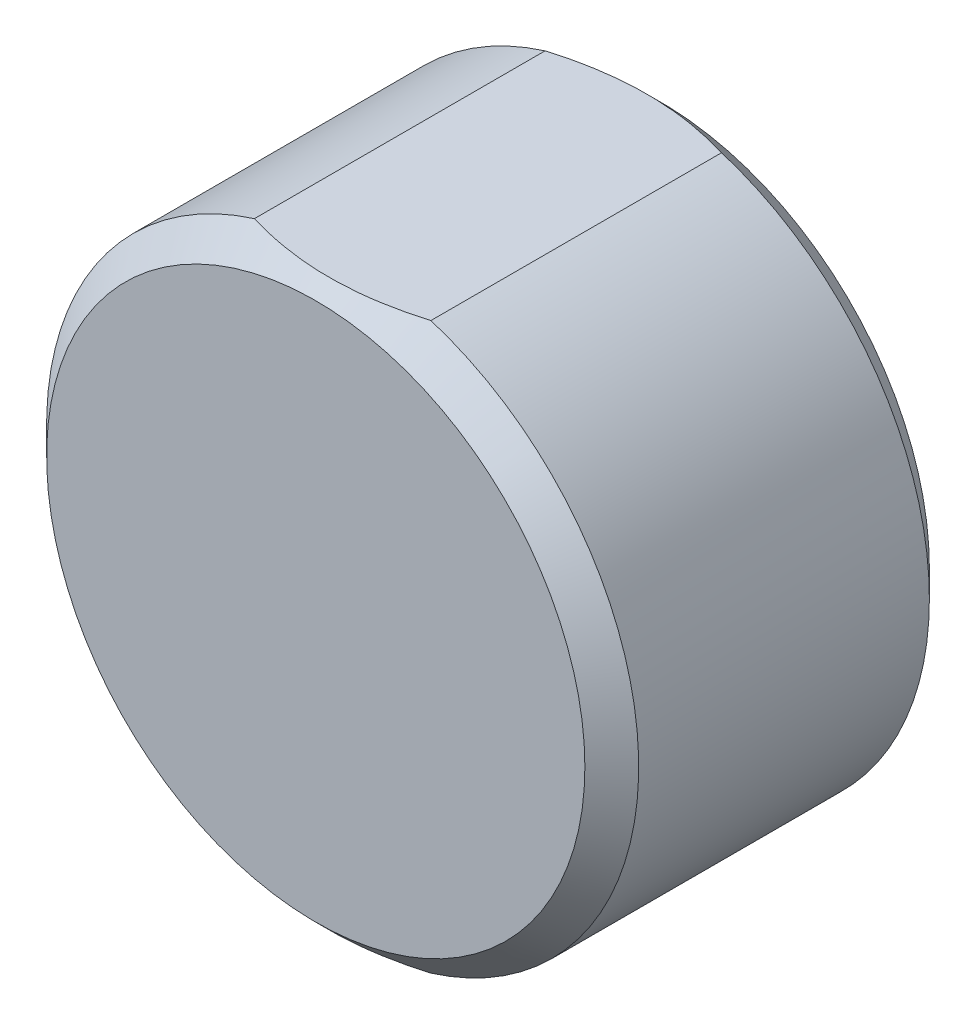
SolidWorks part; units mm, degrees
ref_plane "Ebene vorne" through (0, 0, 0) normal (0, 0, 1) x (1, 0, 0)
ref_plane "Ebene oben" through (0, 0, 0) normal (0, 1, 0) x (1, 0, 0)
ref_plane "Ebene rechts" through (0, 0, 0) normal (1, 0, 0) x (0, 0, -1)
sketch "Skizze1" plane through (0, 0, 0) normal (0, 0, 1) x (1, 0, 0)
  circle A0 centre (0, 0) radius 11
  dimension "H" = 22
extrude "Aufsatz-Linear austragen1" add sketch "Skizze1" along normal blind 12.8
chamfer "Fase1" distance 1 angle 45 2 edges at (11, 0, 0) (11, 0, 12.8)
sketch "Skizze2" plane through (0, 0, 12.8) normal (0, 0, 1) x (1, 0, 0)
  line L0 (-11, 0) -> (11, 0) construction
  line L1 (-3.2787, 10.5) -> (3.2787, 10.5)
  line L2 (-3.2787, 10.5) -> (-3.2787, 11)
  line L3 (-3.2787, 11) -> (3.2787, 11)
  line L4 (3.2787, 10.5) -> (3.2787, 11)
  circle A0 centre (0, 0) radius 11 construction
  dimension "D1" = 21
extrude "Schnitt-Linear austragen1" cut sketch "Skizze2" against normal through all
mirror "Spiegeln1" about plane through (0, 0, 0) normal (0, 1, 0) of "Schnitt-Linear austragen1"
